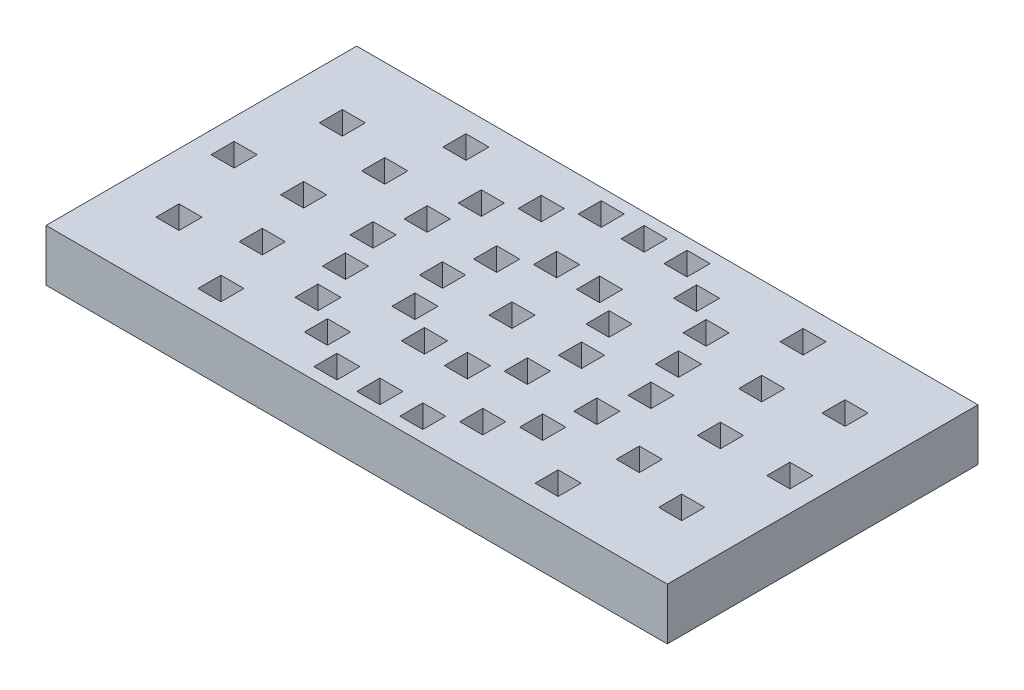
SolidWorks part; units mm, degrees
ref_plane "Front Plane" through (0, 0, 0) normal (0, 0, 1) x (1, 0, 0)
ref_plane "Top Plane" through (0, 0, 0) normal (0, 1, 0) x (1, 0, 0)
ref_plane "Right Plane" through (0, 0, 0) normal (1, 0, 0) x (0, 0, -1)
sketch "Sketch1" plane through (0, 0, 0) normal (0, 1, 0) x (1, 0, 0)
  line L1 (-76.2, 38.1) -> (76.2, 38.1)
  line L2 (-76.2, 38.1) -> (-76.2, -38.1)
  line L3 (-76.2, -38.1) -> (76.2, -38.1)
  line L4 (76.2, 38.1) -> (76.2, -38.1)
  dimension "D1" = 152.4
  dimension "D2" = 76.2
  dimension "D3" = 76.2
  dimension "D4" = 38.1
extrude "Extrude1" add sketch "Sketch1" along normal blind 12.7
other "Fill Pattern3" parameters "D8"=5.6569, "D4"=17.0388, "D5"=15.24, "D3"=0
